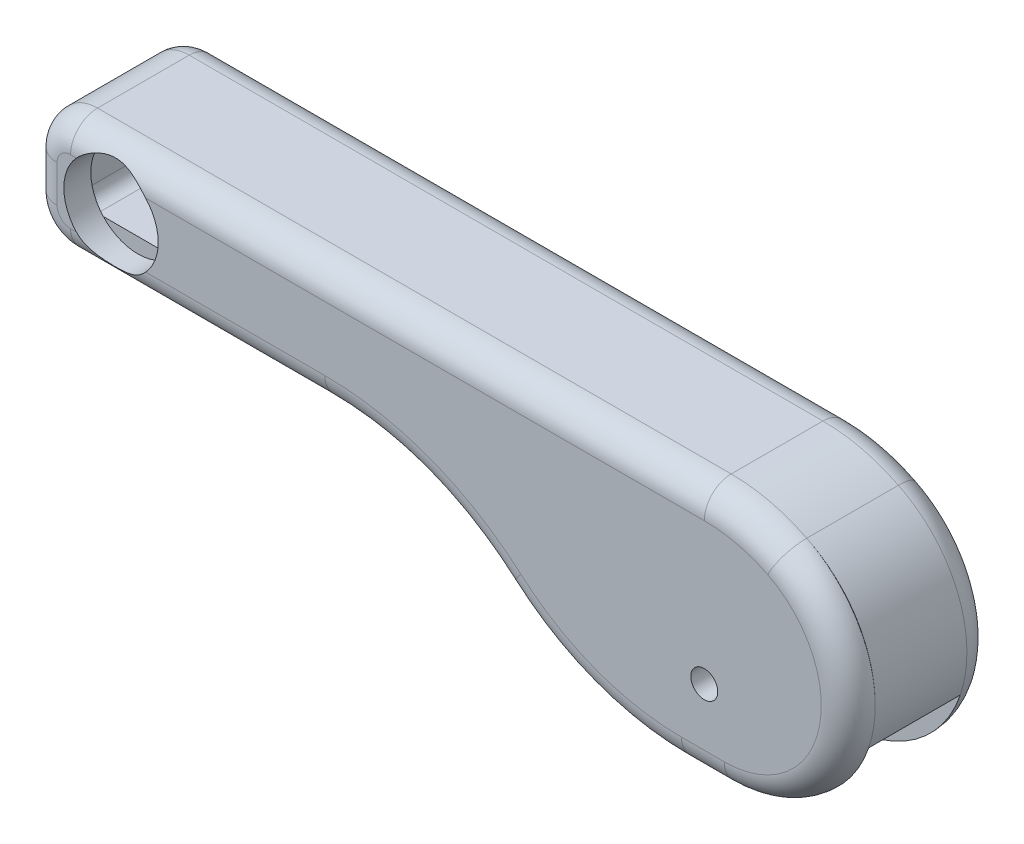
SolidWorks part; units mm, degrees
ref_plane "Front Plane" through (0, 0, 0) normal (0, 0, 1) x (1, 0, 0)
ref_plane "Top Plane" through (0, 0, 0) normal (0, 1, 0) x (1, 0, 0)
ref_plane "Right Plane" through (0, 0, 0) normal (1, 0, 0) x (0, 0, -1)
sketch "Sketch1" plane through (0, 0, 0) normal (0, 0, 1) x (1, 0, 0)
  line L0 (-8.4416, -31.25) -> (7.3951, -31.25)
  line L1 (0, 62.5) -> (-235, 62.5)
  line L3 (-140.7291, 18.75) -> (-235, 18.75)
  line L4 (-250, 47.5) -> (-250, 33.75)
  arc A0 (28.0117, 55.8712) -> (0, 62.5) centre (0, 0) ccw
  arc A1 (-74.5853, -6.25) -> (-140.7291, 18.75) centre (-140.7291, -81.25) ccw
  arc A2 (-235, 18.75) -> (-250, 33.75) centre (-235, 33.75) cw
  arc A3 (-235, 62.5) -> (-250, 47.5) centre (-235, 47.5) ccw
  arc A4 (-8.4416, -31.25) -> (-74.5853, -6.25) centre (-8.4416, 68.75) cw
  arc A5 (7.3951, -31.25) -> (28.0117, 55.8712) centre (7.3951, 14.75) ccw
  point P12 (-250, 62.5)
  dimension "D1" = 125
  dimension "D3" = 100
  dimension "D4" = 15
  dimension "D5" = 100
  dimension "D6" = 46
  dimension "D2" = 250
extrude "Extrude1" add sketch "Sketch1" along normal blind 54
shell "Shell1" thickness 10
sketch "Sketch3" plane through (0, 0, 54) normal (0, 0, 1) x (1, 0, 0)
  circle A0 centre (0, 0) radius 5
  dimension "D1" = 10
extrude "Extrude2" cut sketch "Sketch3" against normal through all
ref_plane "Plane1" through (0, 0, 27) normal (0, 0, 1) x (1, 0, 0)
fillet "Fillet9" radius 10 14 edges at (-245.6066, 58.1066, 54) (-250, 40.625, 54) (-245.6066, 23.1434, 54) (28.0117, 55.8712, 49) (7.3951, -31.25, 49) (-8.4416, -31.25, 49) (-74.5853, -6.25, 49) (-187.8646, 18.75, 54) (-105.3738, 12.2914, 54) (-43.7969, -24.7914, 54) (-0.5232, -31.25, 54) (52.1588, 4.157, 54) (14.3927, 60.8202, 54) (-117.5, 62.5, 54)
fillet "Fillet10" radius 10 14 edges at (-43.7969, -24.7914, 0) (-105.3738, 12.2914, 0) (-187.8646, 18.75, 0) (-245.6066, 23.1434, 0) (-250, 40.625, 0) (-245.6066, 58.1066, 0) (-117.5, 62.5, 0) (14.3927, 60.8202, 0) (28.0117, 55.8712, 5) (7.3951, -31.25, 5) (-8.4416, -31.25, 5) (-74.5853, -6.25, 5) (52.1588, 4.157, 0) (-0.5232, -31.25, 0)
sketch "Sketch6" plane through (0, 0, 0) normal (0, 0, 1) x (1, 0, 0)
  line L0 (-240, 40.625) -> (-220, 40.625)
  line L2 (-240, 47.5) -> (-240, 33.75) construction
  circle A0 centre (-220, 40.625) radius 17.5
  dimension "D2" = 35
  dimension "D1" = 20
extrude "Extrude3" [suppressed] cut sketch "Sketch6" along normal blind 10 contours A0
sketch "Sketch7" plane through (0, 0, 54) normal (0, 0, 1) x (1, 0, 0)
  line L0 (-240, 40.625) -> (-220, 40.625)
  line L1 (-240, 47.5) -> (-240, 33.75) construction
  circle A0 centre (-220, 40.625) radius 17.5
  dimension "D2" = 35
  dimension "D1" = 20
extrude "Extrude4" cut sketch "Sketch7" against normal blind 10 contours A0
sketch "Sketch9" plane through (0, 0, 0) normal (0.8939, -0.4482, 0) x (0, 0, -1)
  line L1 (-10, 62.5) -> (-44, 62.5)
  line L2 (-10, 62.5) -> (-10, 52.5)
  line L3 (-10, 52.5) -> (-44, 52.5)
  line L4 (-44, 62.5) -> (-44, 52.5)
sketch "Sketch10" plane through (0, 0, 27) normal (0, 0, 1) x (1, 0, 0)
  arc A0 (7.3951, -31.25) -> (28.0117, 55.8712) centre (7.3951, 14.75) ccw construction
  spline S0 degree 3 poles (50.9662, 0) (57.7551, 19.993) (50.3783, 44.6963) (28.0117, 55.8712) knots 0 0 0 0 1 1 1 1
sweep "Sweep2" add profiles "Sketch9" path "Sketch10"
